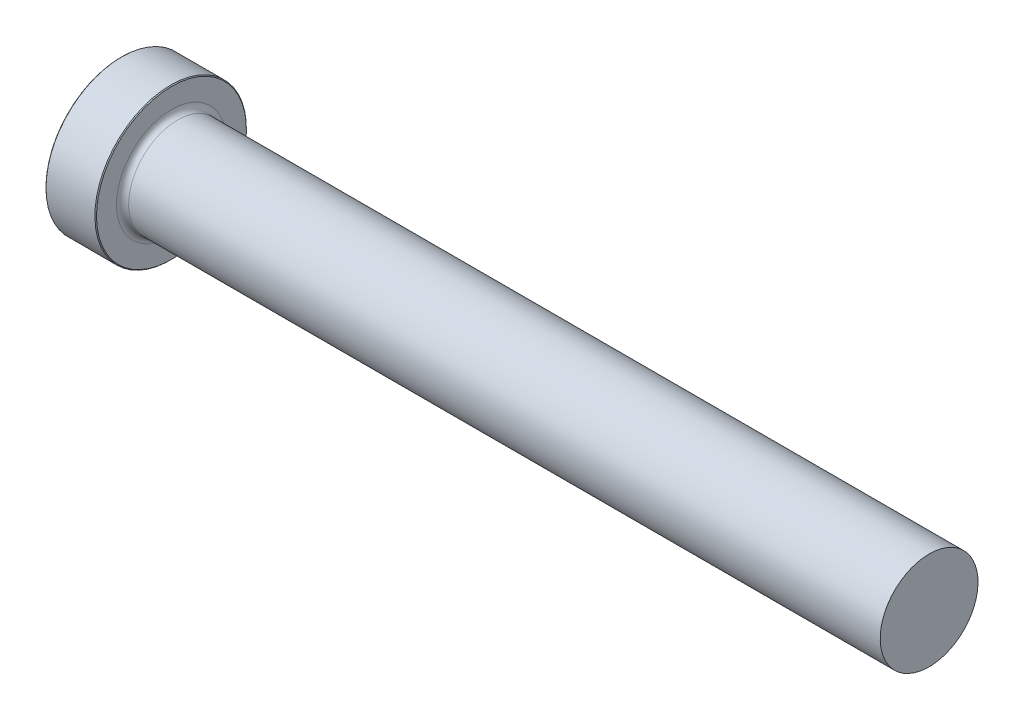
SolidWorks part; units mm, degrees
ref_plane "Front Plane" through (0, 0, 0) normal (0, 0, 1) x (1, 0, 0)
ref_plane "Top Plane" through (0, 0, 0) normal (0, 1, 0) x (1, 0, 0)
ref_plane "Right Plane" through (0, 0, 0) normal (1, 0, 0) x (0, 0, -1)
sketch "Sketch1" plane through (0, 0, 0) normal (0, 0, 1) x (1, 0, 0)
  line L0 (0, 0) -> (0, 9.525)
  line L1 (0, 9.525) -> (6.35, 9.525)
  line L2 (6.35, 9.525) -> (6.35, 6.9098)
  line L3 (7.112, 6.1478) -> (101.6, 6.1478)
  line L4 (101.6, 6.1478) -> (101.6, 0)
  line L5 (101.6, 0) -> (0, 0)
  line L6 (101.6, 0) -> (101.6, -6.1478) construction
  line L7 (101.6, -6.1478) -> (6.35, -6.1478) construction
  line L8 (0, 0) -> (0, -9.525) construction
  line L9 (0, -9.525) -> (6.35, -9.525) construction
  line L10 (6.35, -9.525) -> (6.35, -6.1478) construction
  arc A0 (6.35, 6.9098) -> (7.112, 6.1478) centre (7.112, 6.9098) ccw
  dimension "D4" = 0.762
  dimension "L" = 101.6
  dimension "D" = 12.2955
  dimension "H" = 19.05
  dimension "T" = 6.35
revolve "Revolve1" add sketch "Sketch1" angle 360 about L5
chamfer "Chamfer1" distance 0.1016 angle 45 2 edges at (0, 9.525, 0) (6.35, 9.525, 0)
